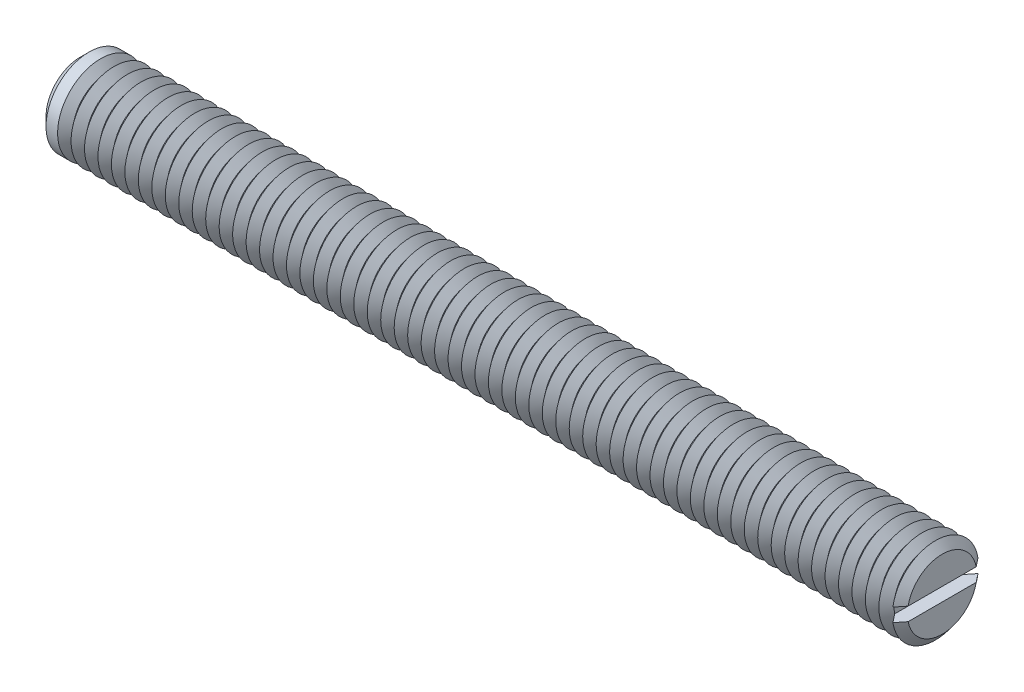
SolidWorks part; units mm, degrees
ref_plane "Front Plane" through (0, 0, 0) normal (0, 0, 1) x (1, 0, 0)
ref_plane "Top Plane" through (0, 0, 0) normal (0, 1, 0) x (1, 0, 0)
ref_plane "Right Plane" through (0, 0, 0) normal (1, 0, 0) x (0, 0, -1)
sketch "Sketch1" plane through (0, 0, 0) normal (1, 0, 0) x (0, 0, -1)
  circle A0 centre (0, 0) radius 4
  dimension "D1" = 8
extrude "Extrude1" add sketch "Sketch1" along normal mid plane 80
sketch "Sketch2" plane through (0, 0, 0) normal (0, 0, 1) x (1, 0, 0)
  line L0 (40, 0.625) -> (38.75, 0.625)
  line L1 (40, -4) -> (40, 4) construction
  line L2 (38.75, 0.625) -> (38.75, -0.625)
  line L3 (0, 0) -> (50000, 0) construction
  line L4 (40, -0.625) -> (38.75, -0.625)
  line L5 (40, -0.625) -> (40, 0.625)
  point P9 (38.75, 0)
  dimension "D1" = 1.25
extrude "Extrude2" cut sketch "Sketch2" against normal mid plane 12
chamfer "Chamfer1" distance 0.8 angle 45 1 edges at (-40, 0, -4)
sketch "Sketch3" plane through (0, 0, 0) normal (0, 0, 1) x (1, 0, 0)
  line L0 (0, 0) -> (30.9602, 0) construction
  line L1 (39.375, -4) -> (40.625, -4)
  line L2 (-39.2, -4) -> (40, -4) construction
  line L3 (40.625, -4) -> (40, -3.2194)
  line L4 (40, -4) -> (40, -0.625) construction
  line L5 (40, -3.2194) -> (39.375, -4)
  dimension "D1" = 1.25
  dimension "D2" = 1
revolve "Cut-Revolve1" cut sketch "Sketch3" angle 360 about L0
pattern_linear "LPattern1" count 63 spacing 1.25 along (-1, 0, 0) of "Cut-Revolve1"
equation "\"D2@Sketch3\" = \"D1@Sketch3\"*0.8"
